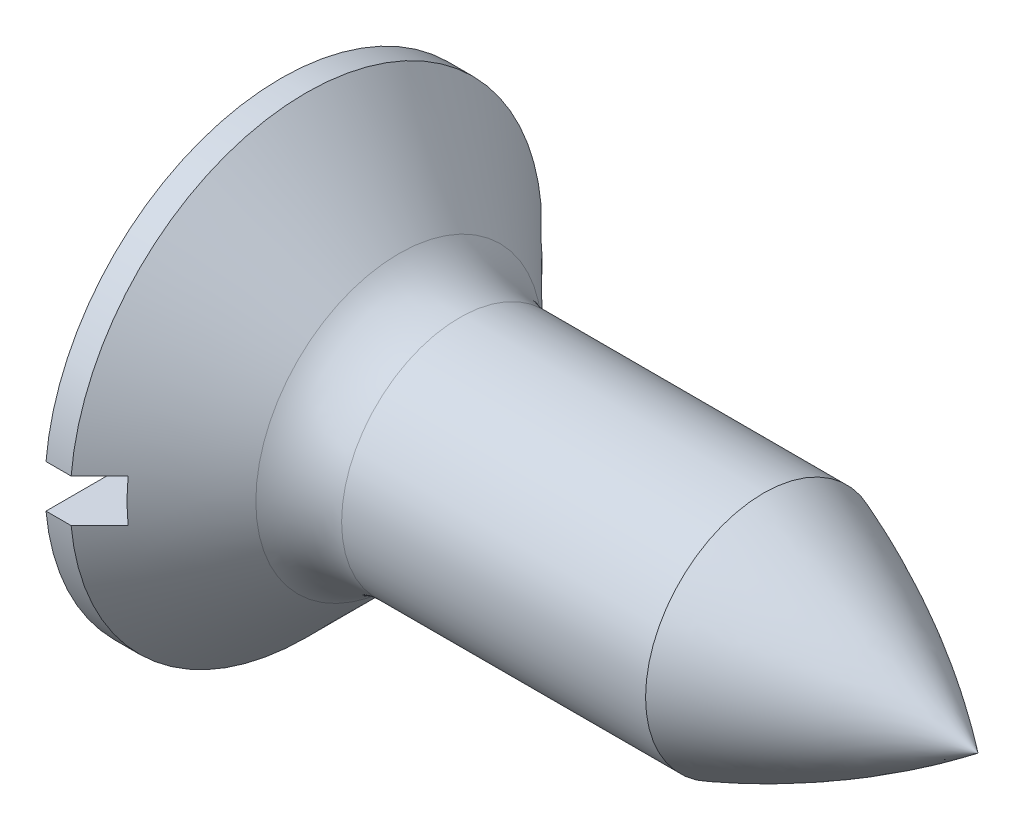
SolidWorks part; units mm, degrees
ref_plane "Front" through (0, 0, 0) normal (0, 0, 1) x (1, 0, 0)
ref_plane "Top" through (0, 0, 0) normal (0, 1, 0) x (1, 0, 0)
ref_plane "Right" through (0, 0, 0) normal (1, 0, 0) x (0, 0, -1)
other "Configuration Table"
sketch "Sketch1" plane through (0, 0, 0) normal (0, 0, 1) x (1, 0, 0)
  line L0 (-9.6945, 0) -> (41.8165, 0) construction
  line L1 (6.5, 0) -> (6.5, 1.1)
  line L2 (6.5, 1.1) -> (1.6657, 1.1)
  line L3 (1.1, 1.3343) -> (0.2343, 2.2)
  line L4 (0.2343, 2.2) -> (0, 2.2)
  line L5 (6.5, 0) -> (0, 0)
  line L6 (1.9, 2.8481) -> (1.9, -2.3177) construction
  line L7 (0, 2.2) -> (0, 0)
  arc A0 (1.6657, 1.1) -> (1.1, 1.3343) centre (1.6657, 1.9) cw
revolve "Base" add sketch "Sketch1" angle 360 about L0
sketch "Sketch2" plane through (0, 0, 0) normal (0, 0, 1) x (1, 0, 0)
  line L0 (0, 2.2) -> (0, -2.2) construction
  line L1 (0, 0.2) -> (0.5, 0.2)
  line L2 (0, 0.2) -> (0, -0.2)
  line L3 (0, -0.2) -> (0.5, -0.2)
  line L4 (0.5, 0.2) -> (0.5, -0.2)
  line L6 (1.1738, 0) -> (-4.2219, 0) construction
  dimension "n" = 0.4
  dimension "t" = 0.5
extrude "Slot" cut sketch "Sketch2" against normal through all and the other way through all
sketch "Sketch3" plane through (0, 0, 0) normal (0, 0, 1) x (1, 0, 0)
  line L0 (1.3282, 0) -> (-13.6388, 0) construction
  line L1 (1.6657, -1.1) -> (6.5, -1.1) construction
  line L2 (4.9, -1.1) -> (5.7, -1.1)
  line L3 (5.7, -1.1) -> (6.5, -0.9)
  line L6 (4.9, -1.1) -> (4.9, -1.6)
  line L7 (4.9, -1.6) -> (6.5, -1.6)
  line L8 (6.5, -1.6) -> (6.5, -0.9)
  line L9 (6.5, -1.1) -> (6.5, 1.1) construction
  point P15 (5.7, -1.1)
revolve "Cut-Revolve1" [suppressed] cut sketch "Sketch3" angle 360 about L0
sketch "Sketch4" plane through (0, 0, 0) normal (0, 0, 1) x (1, 0, 0)
  line L0 (33.2407, 0) -> (9.9121, 0) construction
  line L2 (6.5, -1.1) -> (6.5, 1.1) construction
  line L3 (6.5, 0) -> (4.5, -1.1) construction
  line L6 (6.5, 0) -> (7, 0)
  line L7 (4.5, -1.1) -> (6.5, -1.1)
  line L8 (7, 0) -> (7, -1.1)
  line L9 (7, -1.1) -> (6.5, -1.1)
  arc A0 (6.5, 0) -> (4.5, -1.1) centre (1.6841, 6.388) cw
revolve "Cut-Revolve6" cut sketch "Sketch4" angle 360 about L0
sketch "Sketch5" plane through (0, 0, 0) normal (0, 0, 1) x (1, 0, 0)
  line L0 (1.65, 1.6) -> (2.15, 1.6)
  line L1 (2.15, 1.6) -> (2.15, 1.1)
  line L2 (2.15, 1.1) -> (1.9, 0.667)
  line L3 (1.9, 0.667) -> (1.65, 1.1)
  line L4 (1.65, 1.1) -> (1.65, 1.6)
  line L5 (0, 0) -> (8.4251, 0) construction
revolve "Cut-Revolve10" [suppressed] cut sketch "Sketch5" angle 360 about L5
pattern_linear "LPattern10" [suppressed] count 8 spacing 0.6 along (1, 0, 0)
equation "\"D3@Sketch3\" = \"yf@Sketch3\" / 8"
equation "\"D2@ThreadCosmetic1\" = \"st@Sketch1\" - 1"
equation "\"D1@Sketch4\" = \"yc@Sketch4\" * 4"
equation "\"D3@Sketch4\" = \"st@Sketch1\""
equation "\"D2@Sketch3\" = \"yf@Sketch3\" / 2"
equation "\"D1@ThreadCosmetic1\" = \"l@Sketch1\" - \"k@Sketch1\" - \"a@Sketch1\""
equation "\"D1@Sketch5\" = \"st@Sketch1\""
equation "\"D2@Sketch5\" =  ( \"D1@Sketch5\" - \"D2@ThreadCosmetic1\" )  / 2"
equation "\"D3@Sketch5\" = \"a@Sketch1\""
equation "\"D3@LPattern10\" = \"D2@Sketch5\" * 1.2"
equation "\"D1@LPattern10\" = \"D1@ThreadCosmetic1\" / \"D3@LPattern10\""
